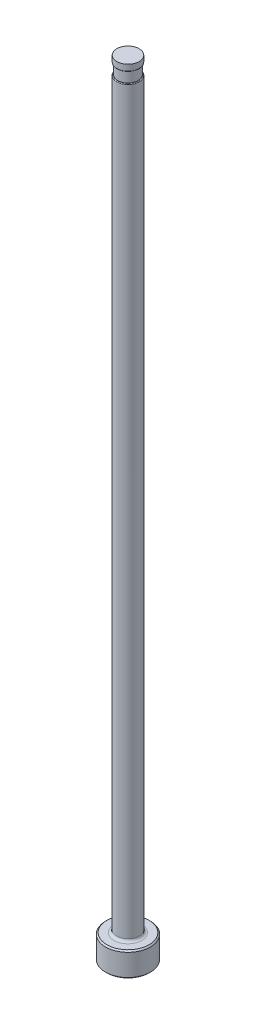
SolidWorks part; units mm, degrees
ref_plane "Front Plane" through (0, 0, 0) normal (0, 0, 1) x (1, 0, 0)
ref_plane "Top Plane" through (0, 0, 0) normal (0, 1, 0) x (1, 0, 0)
ref_plane "Right Plane" through (0, 0, 0) normal (1, 0, 0) x (0, 0, -1)
other "Configuration Table"
sketch "Sketch1" plane through (0, 0, 0) normal (0, 0, 1) x (1, 0, 0)
  line L0 (0, 259.9588) -> (0, -15.1925) construction
  line L1 (0, 0) -> (-4.3561, 0)
  line L2 (-4.3561, 0) -> (-4.3561, 4.7498)
  line L3 (-4.3561, 4.7498) -> (-2.1819, 4.7498)
  line L4 (-2.1819, 4.7498) -> (-2.1819, 152.4)
  line L5 (-2.1819, 152.4) -> (0, 152.4)
  line L6 (0, 152.4) -> (0, 0)
  dimension "L" = 152.4
  dimension "H" = 8.7122
  dimension "T" = 4.7498
  dimension "D" = 4.3637
revolve "Revolve1" add sketch "Sketch1" angle 360 about L0
chamfer "Chamfer1" distance 0.254 angle 45 2 edges at (0, 4.7498, 4.3561) (0, 0, 4.3561)
fillet "Fillet1" radius 0.508 1 edges at (0, 4.7498, 2.1819)
sketch "Sketch2" plane through (0, 0, 0) normal (0, 0, 1) x (1, 0, 0)
  line L0 (-2.1819, 152.4) -> (-2.1819, 5.2578) construction
  line L1 (-2.1819, 151.13) -> (-1.9787, 151.13)
  line L2 (-2.1819, 151.13) -> (-2.1819, 149.098)
  line L3 (-2.1819, 149.098) -> (-1.9787, 149.098)
  line L4 (-1.9787, 151.13) -> (-1.9787, 149.098)
  line L5 (2.1819, 152.4) -> (-2.1819, 152.4) construction
  line L6 (0, 153.4483) -> (0, 147.3282) construction
  dimension "D1" = 2.032
  dimension "N" = 1.27
  dimension "FD" = 0.2032
  dimension "D3" = 3.9573
revolve "Vent Relief" cut sketch "Sketch2" angle 360 about L6
sketch "Sketch3" plane through (0, 0, 0) normal (0, 0, 1) x (1, 0, 0)
  line L0 (-1.9787, 150.114) -> (-1.9787, 86.614)
  line L1 (-1.9787, 151.13) -> (-1.9787, 149.098) construction
  line L2 (-2.1819, 149.098) -> (-2.1819, 5.2578) construction
  line L3 (-2.1819, 85.4964) -> (-2.1819, 150.114)
  line L4 (-2.1819, 150.114) -> (-1.9787, 150.114)
  arc A0 (-1.9787, 86.614) -> (-2.1819, 85.4964) centre (-5.1537, 86.614) cw
  dimension "D1" = 3.175
  dimension "D2" = 63.5
extrude "D-Slot" cut sketch "Sketch3" against normal through all both and the other way through all
sketch "Sketch5" plane through (0, 0, 0) normal (0, 0, 1) x (1, 0, 0)
  line L0 (-2.1819, 151.13) -> (2.1819, 151.13) construction
  line L1 (-2.1819, 152.4) -> (-2.1692, 152.4)
  line L2 (-2.1819, 152.4) -> (-2.1819, 151.13)
  line L3 (-2.1819, 151.13) -> (-2.1692, 151.13)
  line L4 (-2.1692, 152.4) -> (-2.1692, 151.13)
  line L5 (0, 152.6877) -> (0, 150.5771) construction
  dimension "VP" = 0.0127
revolve "Vent Diameter" cut sketch "Sketch5" angle 360 about L5
fillet "Fillet2" radius 0.127 2 edges at (2.1819, 149.098, 0) (0, 151.13, 2.1692)
sketch "Pocket Sketch" plane through (0, 0, 0) normal (0, 0, 1) x (1, 0, 0)
  line L0 (-4.753, 0) -> (-4.753, 4.7752)
  line L1 (-4.753, 4.7752) -> (-3.1423, 4.7752)
  line L2 (-2.3803, 5.5372) -> (-2.3803, 22.225)
  line L3 (-2.3803, 22.225) -> (0, 22.225)
  line L4 (0, 22.225) -> (0, 0)
  line L5 (0, 0) -> (-4.753, 0)
  line L6 (0, 12.6104) -> (0, -2.4989) construction
  line L7 (-4.3561, 4.4958) -> (-4.3561, 0.254) construction
  line L8 (4.1021, 4.7498) -> (-4.1021, 4.7498) construction
  line L9 (-2.1819, 85.4964) -> (-2.1819, 5.2578) construction
  line L10 (-3.1423, 4.7752) -> (-2.3803, 5.5372)
  point P3 (-2.3803, 4.7752)
  dimension "D1" = 9.5059
  dimension "D2" = 0.3969
  dimension "D3" = 0.0254
  dimension "D4" = 0.1984
  dimension "D5" = 4.7606
  dimension "D6" = 22.225
